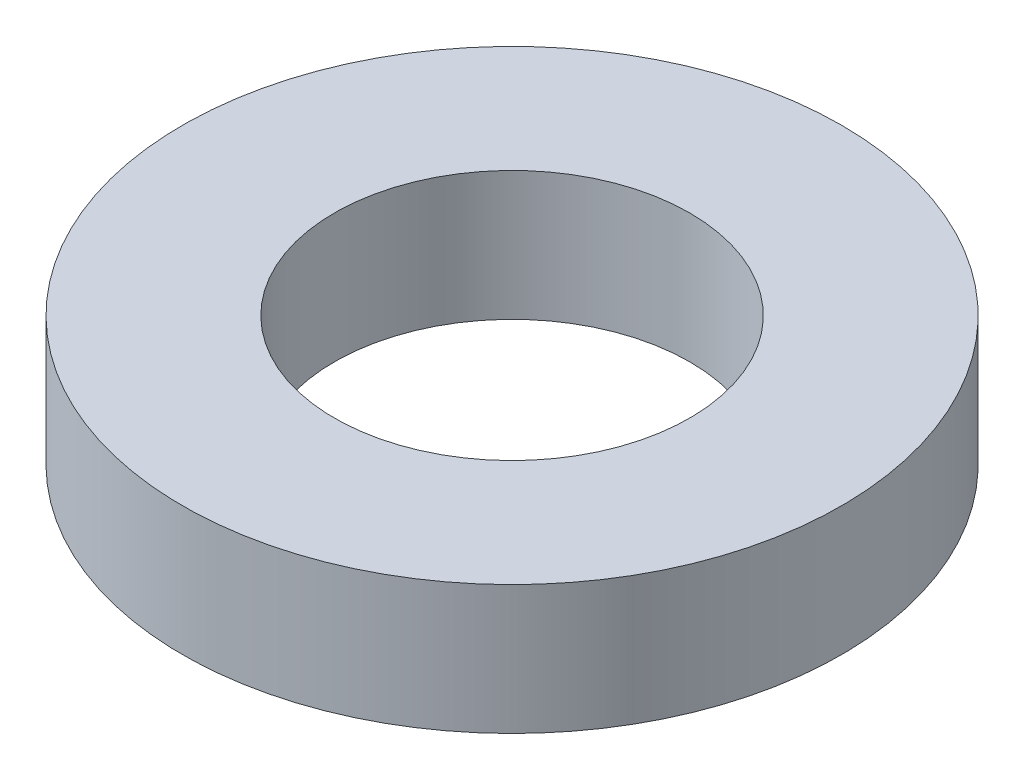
SolidWorks part; units mm, degrees
ref_plane "Front" through (0, 0, 0) normal (0, 0, 1) x (1, 0, 0)
ref_plane "Top" through (0, 0, 0) normal (0, 1, 0) x (1, 0, 0)
ref_plane "Right" through (0, 0, 0) normal (1, 0, 0) x (0, 0, -1)
sketch "Sketch1" plane through (0, 0, 0) normal (0, 0, 1) x (1, 0, 0)
  line L0 (-1.5748, 0) -> (1.5748, 0) construction
  line L1 (2.921, -0.5715) -> (2.921, 0.5715)
  line L2 (2.921, 0.5715) -> (1.5748, 0.5715)
  line L3 (0, -11.4126) -> (0, 23.1775) construction
  line L4 (0, -0.6286) -> (0, 0.6286) construction
  line L6 (2.921, -0.5715) -> (1.5748, -0.5715)
  line L7 (1.5748, 0.5715) -> (1.5748, -0.5715)
  point P4 (1.5748, 0)
  dimension "ID" = 3.1496
  dimension "thick" = 1.143
  dimension "Wd" = 1.3462
revolve "Revolve2" add sketch "Sketch1" angle 360 about L3
sketch "Sketch4" plane through (0, 0.5715, 0) normal (0, 1, 0) x (1, 0, 0)
  line L0 (-1.5748, 0) -> (1.5748, 0) construction
  line L1 (-2.921, 0) -> (-1.5748, 0) construction
  circle A0 centre (0, 0) radius 1.5748 construction
  circle A1 centre (0, 0) radius 2.921
  circle A2 centre (0, 0) radius 2.921
  dimension "D2" = 3.1496
  dimension "D3" = 1.3462
  dimension "D1" = 0
